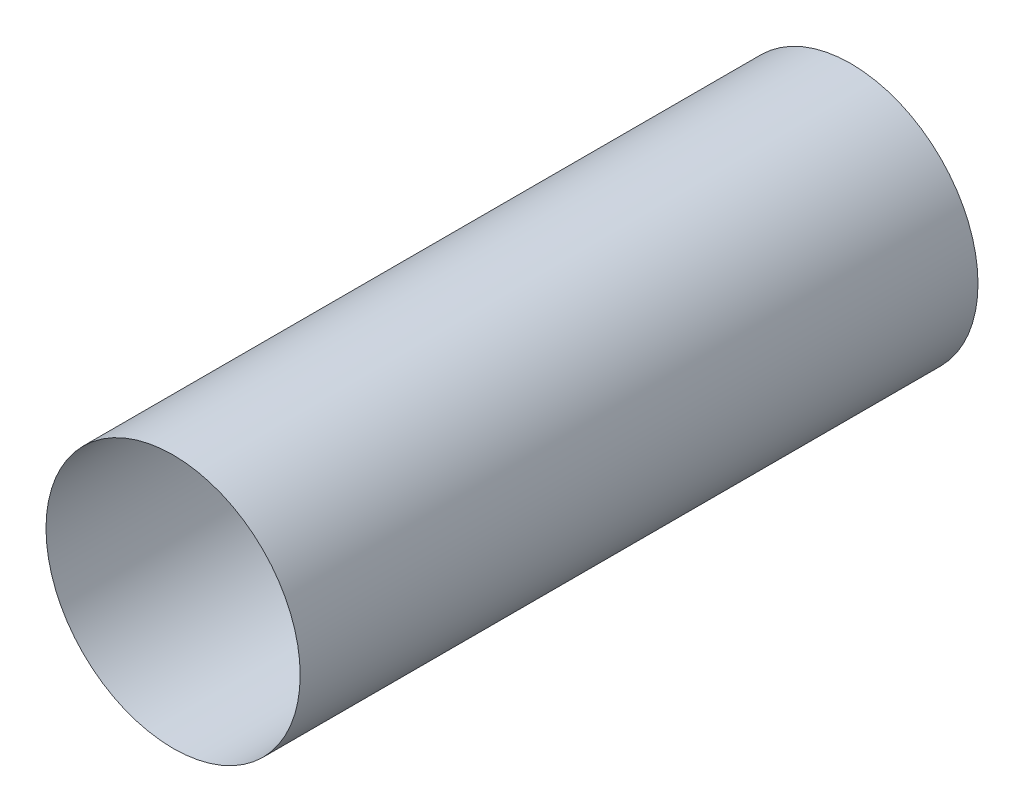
SolidWorks part; units mm, degrees
ref_plane "Front Plane" through (0, 0, 0) normal (0, 0, 1) x (1, 0, 0)
ref_plane "Top Plane" through (0, 0, 0) normal (0, 1, 0) x (1, 0, 0)
ref_plane "Right Plane" through (0, 0, 0) normal (1, 0, 0) x (0, 0, -1)
sketch "Sketch1" plane through (0, 0, 0) normal (0, 0, 1) x (1, 0, 0)
  circle A0 centre (0, 0) radius 38.1
  dimension "D1" = 76.2
surface "Surface-Extrude1" sketch "Sketch1" parameters "D1"=203.2
